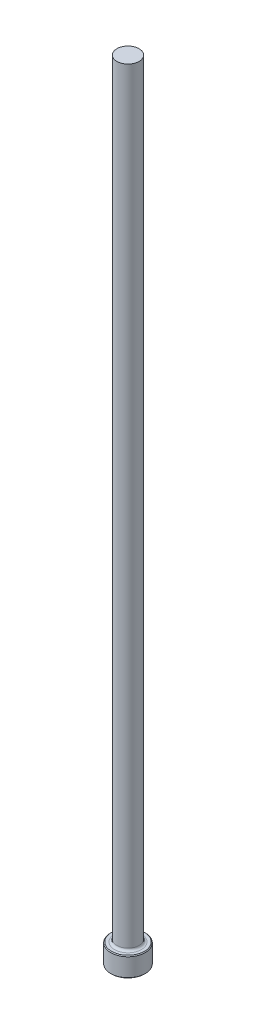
SolidWorks part; units mm, degrees
ref_plane "Front Plane" through (0, 0, 0) normal (0, 0, 1) x (1, 0, 0)
ref_plane "Top Plane" through (0, 0, 0) normal (0, 1, 0) x (1, 0, 0)
ref_plane "Right Plane" through (0, 0, 0) normal (1, 0, 0) x (0, 0, -1)
sketch "Sketch1" plane through (0, 0, 0) normal (0, 0, 1) x (1, 0, 0)
  line L0 (0, 259.9588) -> (0, -15.1925) construction
  line L1 (0, 0) -> (-5.5499, 0)
  line L2 (-5.5499, 0) -> (-5.5499, 6.35)
  line L3 (-5.5499, 6.35) -> (-3.5712, 6.35)
  line L4 (-3.5712, 6.35) -> (-3.5712, 254)
  line L5 (-3.5712, 254) -> (0, 254)
  line L6 (0, 254) -> (0, 0)
  dimension "L" = 254
  dimension "H" = 11.0998
  dimension "T" = 6.35
  dimension "D" = 7.1425
revolve "Revolve1" add sketch "Sketch1" angle 360 about L0
chamfer "Chamfer1" distance 0.254 angle 45 2 edges at (0, 6.35, 5.5499) (0, 0, 5.5499)
fillet "Fillet1" radius 0.762 1 edges at (0, 6.35, 3.5712)
sketch "Pocket Sketch" plane through (0, 0, 0) normal (0, 0, 1) x (1, 0, 0)
  line L0 (-5.9468, 0) -> (-5.9468, 6.3754)
  line L1 (-5.9468, 6.3754) -> (-4.7301, 6.3754)
  line L2 (-3.9681, 7.1374) -> (-3.9681, 22.225)
  line L3 (-3.9681, 22.225) -> (0, 22.225)
  line L4 (0, 22.225) -> (0, 0)
  line L5 (0, 0) -> (-5.9468, 0)
  line L6 (0, 12.6104) -> (0, -2.4989) construction
  line L7 (-5.5499, 6.096) -> (-5.5499, 0.254) construction
  line L8 (5.2959, 6.35) -> (-5.2959, 6.35) construction
  line L9 (-3.5712, 254) -> (-3.5712, 7.112) construction
  line L10 (-4.7301, 6.3754) -> (-3.9681, 7.1374)
  point P3 (-3.9681, 6.3754)
  dimension "D1" = 11.8935
  dimension "D2" = 0.3969
  dimension "D3" = 0.0254
  dimension "D4" = 0.3969
  dimension "D5" = 7.9362
  dimension "D6" = 22.225
